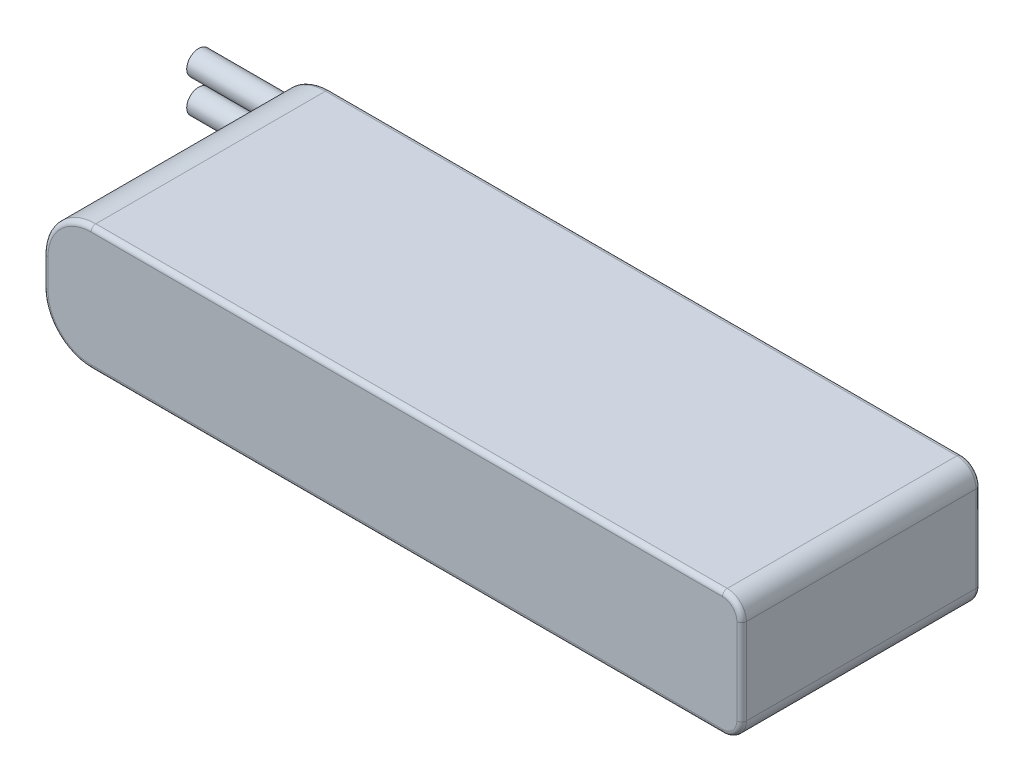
SolidWorks part; units mm, degrees
ref_plane "Front Plane" through (0, 0, 0) normal (0, 0, 1) x (1, 0, 0)
ref_plane "Top Plane" through (0, 0, 0) normal (0, 1, 0) x (1, 0, 0)
ref_plane "Right Plane" through (0, 0, 0) normal (1, 0, 0) x (0, 0, -1)
sketch "Sketch1" plane through (0, 0, 0) normal (0, 1, 0) x (1, 0, 0)
  line L1 (73, -25) -> (-73, -25)
  line L2 (73, -25) -> (73, 25)
  line L3 (73, 25) -> (-73, 25)
  line L4 (-73, -25) -> (-73, 25)
  line L5 (73, -25) -> (-73, 25) construction
  line L6 (73, 25) -> (-73, -25) construction
  point P0 (0, 0)
  dimension "D1" = 50
  dimension "D2" = 146
extrude "Boss-Extrude1" add sketch "Sketch1" along normal blind 26
fillet "Fillet1" radius 4 2 edges at (73, 0, 0) (73, 26, 0)
fillet "Fillet2" radius 10 2 edges at (-73, 0, 0) (-73, 26, 0)
fillet "Fillet3" radius 1 16 edges at (-70.0711, 23.0711, 25) (-73, 13, 25) (-70.0711, 2.9289, 25) (3, 0, 25) (71.8284, 1.1716, 25) (73, 13, 25) (71.8284, 24.8284, 25) (71.8284, 24.8284, -25) (73, 13, -25) (71.8284, 1.1716, -25) (3, 0, -25) (-70.0711, 2.9289, -25) (-73, 13, -25) (-70.0711, 23.0711, -25) (3, 26, 25) (3, 26, -25)
sketch "Sketch2" plane through (-73, 0, 0) normal (-1, 0, 0) x (0, 0, 1)
  line L0 (-25.5, 9.5) -> (-25.5, 16.5) construction
  line L1 (-24, 16) -> (-24, 10) construction
  line L2 (-28, 16.5) -> (-28, 9.5) construction
  line L3 (25, 16) -> (25, 10) construction
  circle A0 centre (-25.5, 16.5) radius 2.5
  circle A1 centre (-25.5, 9.5) radius 2.5
  point P7 (-24, 13)
  point P8 (-25.5, 13)
  dimension "D1" = 5
  dimension "D2" = 53
  dimension "D3" = 7
extrude "Boss-Extrude2" add sketch "Sketch2" along normal blind 18 and the other way blind 10
